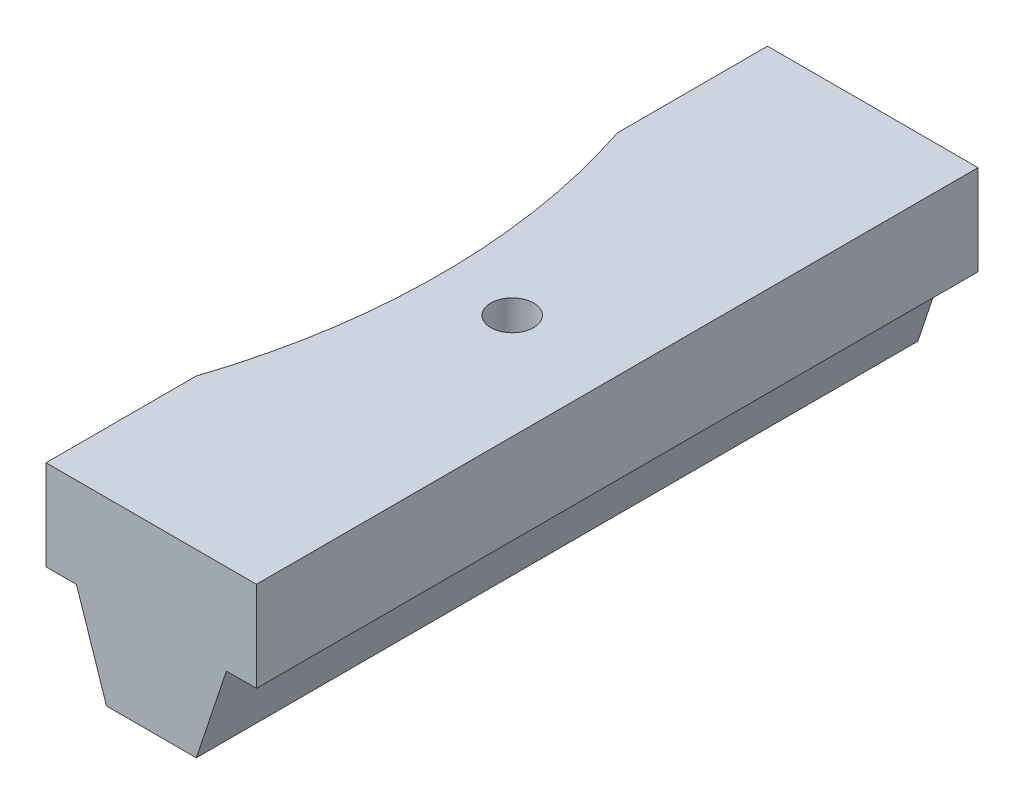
SolidWorks part; units mm, degrees
ref_plane "Front Plane" through (0, 0, 0) normal (0, 0, 1) x (1, 0, 0)
ref_plane "Top Plane" through (0, 0, 0) normal (0, 1, 0) x (1, 0, 0)
ref_plane "Right Plane" through (0, 0, 0) normal (1, 0, 0) x (0, 0, -1)
sketch "Sketch1" plane through (0, 0, 0) normal (0, 0, 1) x (1, 0, 0)
  line L0 (-3.9592, -117.094) -> (3.9592, -117.094) construction
  line L1 (3.9592, -117.094) -> (2.3717, -121.8565)
  line L2 (2.3717, -121.8565) -> (-2.3717, -121.8565)
  line L3 (-2.3717, -121.8565) -> (-3.9592, -117.094)
  line L4 (0, -117.094) -> (0, -121.8565) construction
  line L5 (-3.9592, -117.094) -> (-3.9592, -113.919) construction
  line L6 (-5.5658, -112.3315) -> (5.5467, -112.3315)
  line L7 (3.9592, -112.3315) -> (3.9592, -117.094) construction
  line L8 (5.5467, -112.3315) -> (5.5467, -117.094)
  line L9 (-5.5658, -112.3315) -> (-5.5658, -117.094)
  line L10 (3.9592, -117.094) -> (5.5467, -117.094)
  line L11 (-3.9592, -117.094) -> (-5.5658, -117.094)
  dimension "D1" = 7.9185
  dimension "D2" = 4.7435
  dimension "D3" = 4.7625
  dimension "D4" = 4.7625
  dimension "D5" = 117.094
  dimension "D6" = 112.3315
  dimension "D7" = 11.1125
  dimension "D8" = 1.5875
extrude "Extrude1" add sketch "Sketch1" along normal mid plane 38.1
hole_wizard "#4-40 Tapped Hole1" positions "Sketch3" profile "Sketch2" tap size "#4-40" standard "Ansi Inch"
sketch "Sketch3" plane through (-0.2907, -112.3315, -13.1999) normal (0, 1, 0) x (-1, 0, 0)
  point P0 (-0.2907, 13.1999)
sketch "Sketch2" plane through (0, -112.3315, 0) normal (1, 0, 0) x (0, 0, 1)
  line L0 (0, 0) -> (0, 9.525)
  line L1 (0, 9.525) -> (1.1303, 9.525)
  line L2 (1.1303, 9.525) -> (1.1303, 0)
  line L5 (1.1303, 0) -> (0, 0)
  line L11 (0, -6.35) -> (0, 107.95) construction
  dimension "Thru Tap Drill Dia." = 2.2606
  dimension "Thru Tap Drill Depth" = 9.525
sketch "Sketch6" plane through (0, 0, 0) normal (0, 1, 0) x (1, 0, 0)
  circle A0 centre (-39.1414, 0) radius 35.3695
  dimension "D1" = 70.739
  dimension "D2" = 39.1414
extrude "Cut-Extrude1" cut sketch "Sketch6" against normal through all
hole_wizard "CBORE for #4 Socket Head Cap Screw1" positions "Sketch5" profile "Sketch4" counterbore size "#4" standard "Ansi Inch"
sketch "Sketch5" plane through (-0.2809, -112.3315, -9.9112) normal (0, 1, 0) x (-1, 0, 0)
  point P0 (-0.2809, 9.9112)
sketch "Sketch4" plane through (0, -112.3315, 0) normal (1, 0, 0) x (0, 0, 1)
  line L0 (0, 0) -> (0, 9.525)
  line L1 (0, 9.525) -> (1.6319, 9.525)
  line L3 (1.6319, 9.525) -> (1.6319, 3.8608)
  line L4 (2.7788, 3.8608) -> (1.6319, 3.8608)
  line L5 (2.7788, 3.8608) -> (2.7788, 1.0319)
  line L6 (2.7788, 1.0319) -> (3.8106, 0)
  line L7 (3.8106, 0) -> (0, 0)
  line L8 (-2.7788, 1.0319) -> (-3.8106, 0) construction
  line L11 (0, -6.35) -> (0, 107.95) construction
  dimension "Thru Hole Dia." = 3.2639
  dimension "Thru Hole Depth" = 7.9375
  dimension "C'Bore Dia." = 5.5575
  dimension "C'Bore Depth" = 2.8448
  dimension "Near C'Sink Dia." = 7.6213
  dimension "Near C'Sink Angle" = 90
hole_wizard "#30 (0.1285) Diameter Hole1" positions "Sketch8" profile "Sketch7" hole size "#30" standard "Ansi Inch"
sketch "Sketch8" plane through (0, -112.3315, 0) normal (0, 1, 0) x (-1, 0, 0)
  point P0 (0, 0)
sketch "Sketch7" plane through (0, -112.3315, 0) normal (1, 0, 0) x (0, 0, 1)
  line L0 (0, 0) -> (0, 9.525)
  line L1 (0, 9.525) -> (1.6319, 9.525)
  line L2 (1.6319, 9.525) -> (1.6319, 0)
  line L5 (1.6319, 0) -> (0, 0)
  line L11 (0, -6.35) -> (0, 107.95) construction
  dimension "Thru Hole Dia." = 3.2639
  dimension "Thru Hole Depth" = 9.525
equation "\"Buoyancy\"=\"SW-Volume\"*(\"SW-Density\"-.037062)"
